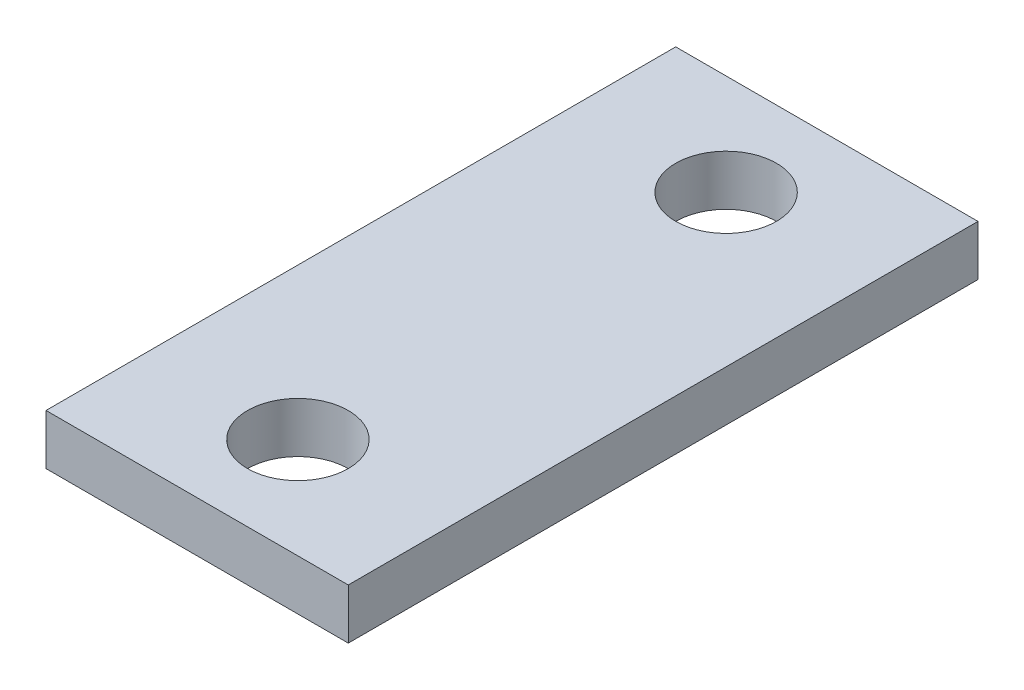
SolidWorks part; units mm, degrees
ref_plane "Front Plane" through (0, 0, 0) normal (0, 0, 1) x (1, 0, 0)
ref_plane "Top Plane" through (0, 0, 0) normal (0, 1, 0) x (1, 0, 0)
ref_plane "Right Plane" through (0, 0, 0) normal (1, 0, 0) x (0, 0, -1)
sketch "Sketch1" plane through (0, 0, 0) normal (0, 1, 0) x (1, 0, 0)
  line L0 (6, 25) -> (6, 0) construction
  line L1 (0, 0) -> (12, 0)
  line L2 (0, 0) -> (0, 25)
  line L3 (0, 25) -> (12, 25)
  line L4 (12, 0) -> (12, 25)
  circle A0 centre (6, 21) radius 2
  circle A1 centre (6, 4) radius 2
  dimension "D3" = 17
  dimension "D4" = 4
  dimension "D5" = 4
  dimension "D1" = 12
  dimension "D2" = 25
extrude "Boss-Extrude1" add sketch "Sketch1" along normal blind 2
